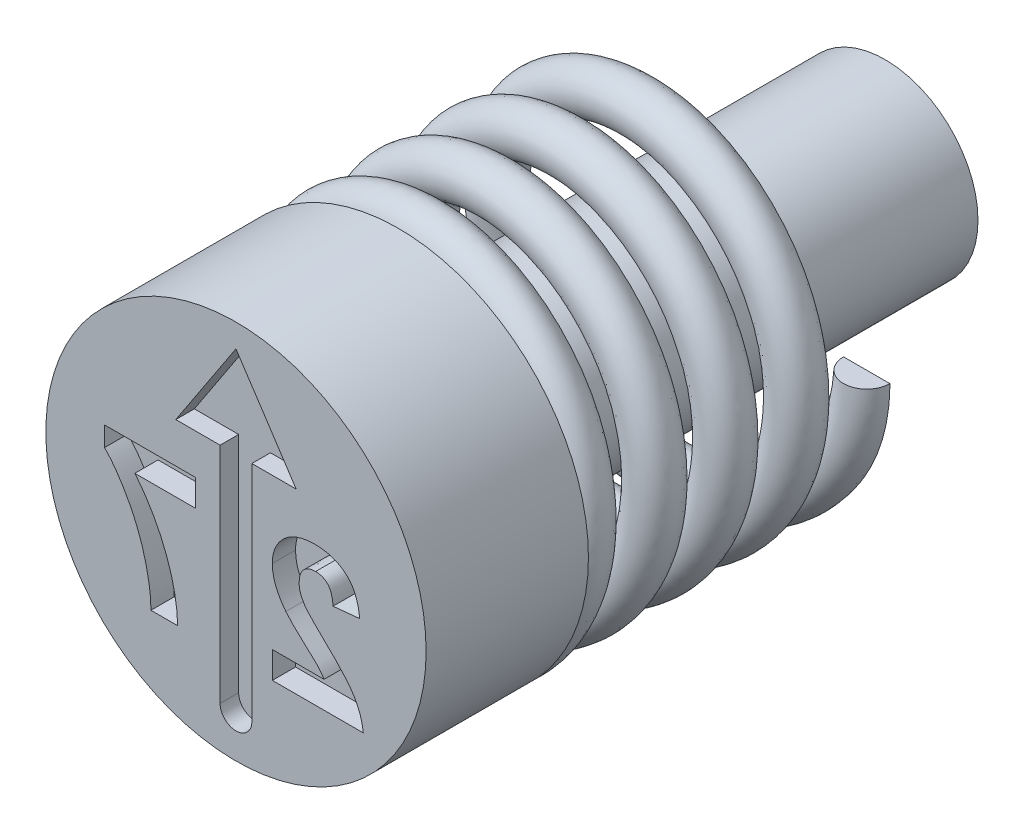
SolidWorks part; units mm, degrees
other "<DCSPR16>-<Cut-Extrude1>"
ref_plane "Front Plane" through (0, 0, 0) normal (0, 0, 1) x (1, 0, 0)
ref_plane "Top Plane" through (0, 0, 0) normal (0, 1, 0) x (1, 0, 0)
ref_plane "Right Plane" through (0, 0, 0) normal (1, 0, 0) x (0, 0, -1)
sketch "Sketch2" plane through (0, 0, 0) normal (0, 1, 0) x (1, 0, 0)
  line L5 (4.1, 0) -> (4.1, 3.5)
  line L6 (4.1, 3.5) -> (2, 3.5)
  line L7 (2, 3.5) -> (2, 14)
  line L8 (2, 14) -> (0, 14)
  line L9 (0, 0) -> (4.1, 0)
  line L10 (0, 0) -> (0, 50000) construction
  line L11 (0, 14) -> (0, 0)
  dimension "D1" = 3.5
  dimension "D2" = 14
  dimension "D3" = 8.2
  dimension "D4" = 4
revolve "Revolve1" add sketch "Sketch2" angle 360 about L10
sketch "Sketch3" plane through (0, 0, 0) normal (0, 0, 1) x (1, 0, 0)
  line L0 (-0.3424, 1.6293) -> (-1.2978, 1.6293)
  line L1 (0, -0.9219) -> (0, 0.9385) construction
  line L2 (-0.3424, -3.193) -> (-0.3424, 1.6293)
  line L3 (-1.2978, 1.6293) -> (0, 3.5991)
  line L12 (1.2978, 1.6293) -> (0, 3.5991)
  line L16 (0.3424, -3.193) -> (0.3424, 1.6293)
  line L17 (0.3424, 1.6293) -> (1.2978, 1.6293)
  arc A2 (-0.3424, -3.193) -> (0.3424, -3.193) centre (0, -3.193) ccw
extrude "Cut-Extrude1" cut sketch "Sketch3" against normal blind 0.4
sketch "Sketch4" plane through (0, 0, 0) normal (0, 0, 1) x (1, 0, 0)
  text T0 "2  7" font "Arial" height 3
  dimension "D1" = 2.2
  dimension "D2" = 2.9
extrude "Cut-Extrude2" cut sketch "Sketch4" against normal blind 0.5
inserted part "DCSPR16"
move or copy body "Body-Move/Copy2" placed by mates yes
